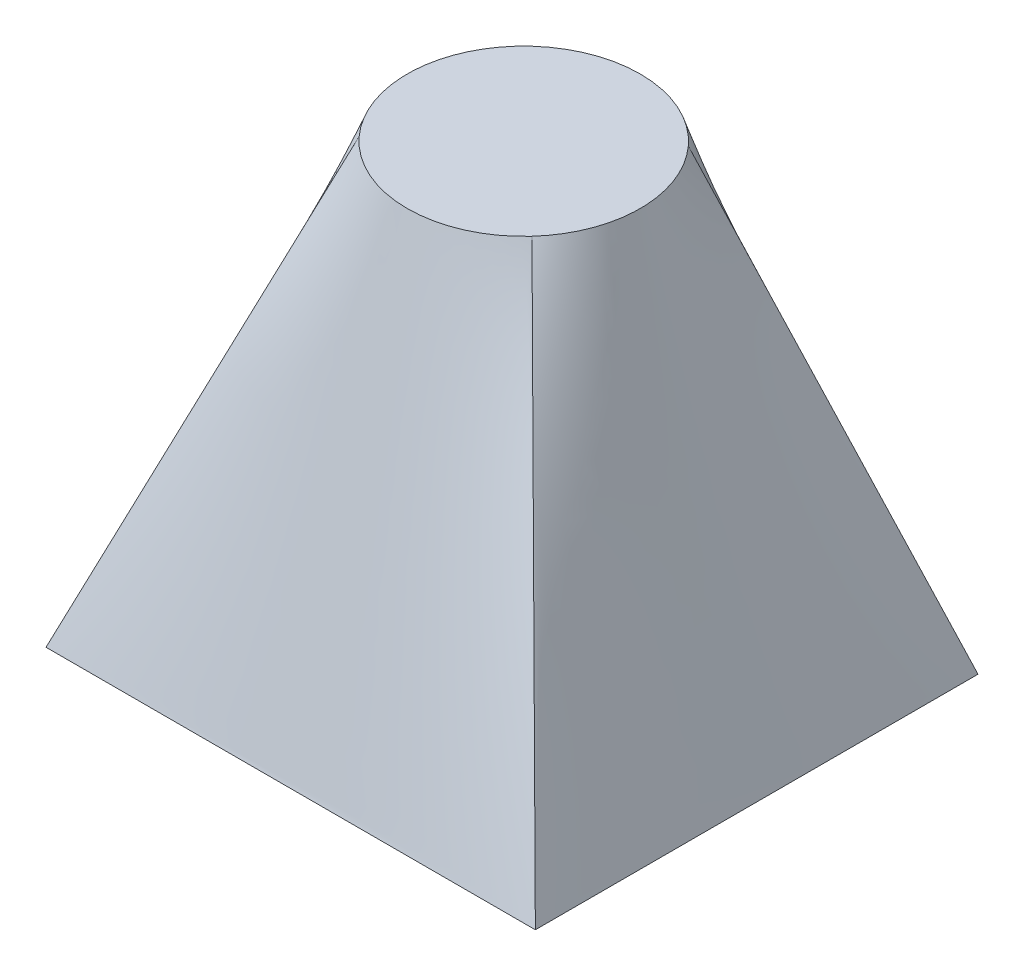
SolidWorks part; units mm, degrees
ref_plane "Plane1" through (0, 0, 0) normal (0, 0, 1) x (1, 0, 0)
ref_plane "Plane2" through (0, 0, 0) normal (0, 1, 0) x (1, 0, 0)
ref_plane "Plane3" through (0, 0, 0) normal (1, 0, 0) x (0, 0, -1)
sketch "Sketch1" plane through (0, 0, 0) normal (0, 1, 0) x (1, 0, 0)
  line L0 (-27.5498, -23.6004) -> (27.5498, 23.6004) construction
  line L1 (-27.5498, -26.2411) -> (27.5498, -26.2411)
  line L2 (-27.5498, -26.2411) -> (-27.5498, 23.6004)
  line L3 (-27.5498, 23.6004) -> (27.5498, 23.6004)
  line L4 (27.5498, -26.2411) -> (27.5498, 23.6004)
ref_plane "Plane4" through (0, 50, 0) normal (0, 1, 0) x (-1, 0, 0)
sketch "Sketch2" plane through (0, 50, 0) normal (0, 1, 0) x (-1, 0, 0)
  circle A0 centre (0, 0) radius 13.1213
loft "Base-Loft" add profiles "Sketch1", "Sketch2"
